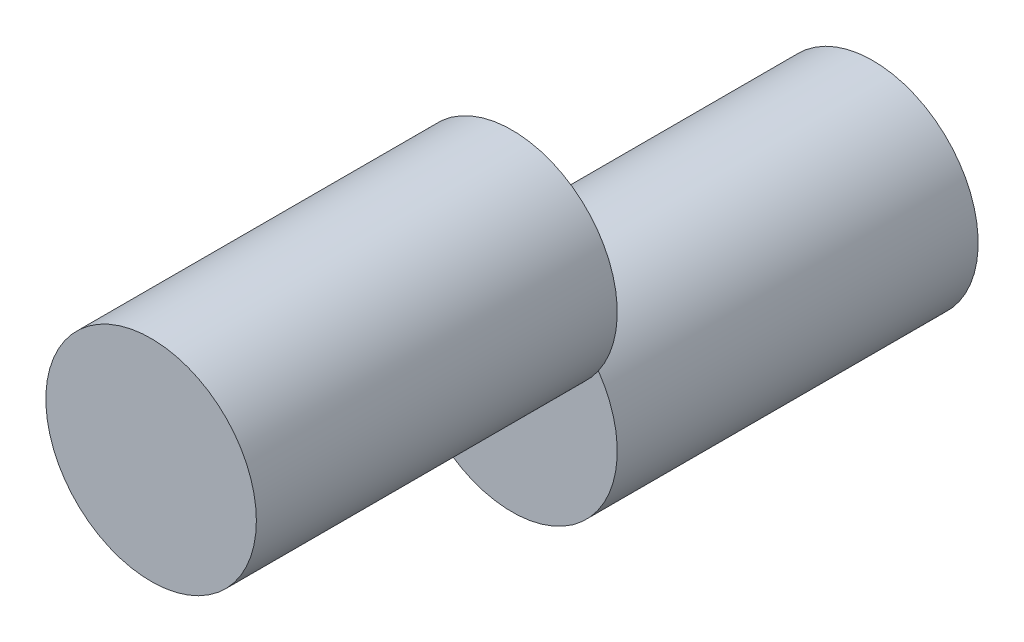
SolidWorks part; units mm, degrees
ref_plane "Front Plane" through (0, 0, 0) normal (0, 0, 1) x (1, 0, 0)
ref_plane "Top Plane" through (0, 0, 0) normal (0, 1, 0) x (1, 0, 0)
ref_plane "Right Plane" through (0, 0, 0) normal (1, 0, 0) x (0, 0, -1)
sketch "Sketch2" plane through (0, 0, 0) normal (0, 0, 1) x (1, 0, 0)
  circle A0 centre (0, 0) radius 44.45
extrude "Boss-Extrude1" add sketch "Sketch2" along normal blind 152.4
sketch "Sketch3" plane through (0, 0, 0) normal (0, 0, -1) x (-1, 0, 0)
  circle A0 centre (0, -50.8) radius 44.45
extrude "Boss-Extrude2" add sketch "Sketch3" along normal blind 152.4
sketch "Sketch4" plane through (0, 0, 152.4) normal (0, 0, 1) x (1, 0, 0)
  circle A0 centre (0, -50.8) radius 14.8167
equation "\"D1@Sketch2\"=\"R\"/2"
equation "\"D1@Sketch3\"=\"E\""
equation "\"D2@Sketch3\"=\"R\"/2"
equation "\"D1@Sketch4\"=\"R\"/6"
equation "\"D2@Sketch4\"=\"E\""
equation "\"D1@Boss-Extrude1\"=\"W\""
equation "\"D1@Boss-Extrude2\"=\"W\""
equation "\"E\"= 2.000000"
equation "\"R\"= 7.000000"
equation "\"RRS\"= 37.100000"
equation "\"HHS\"= 9.000000"
equation "\"W\"= 6.000000"
